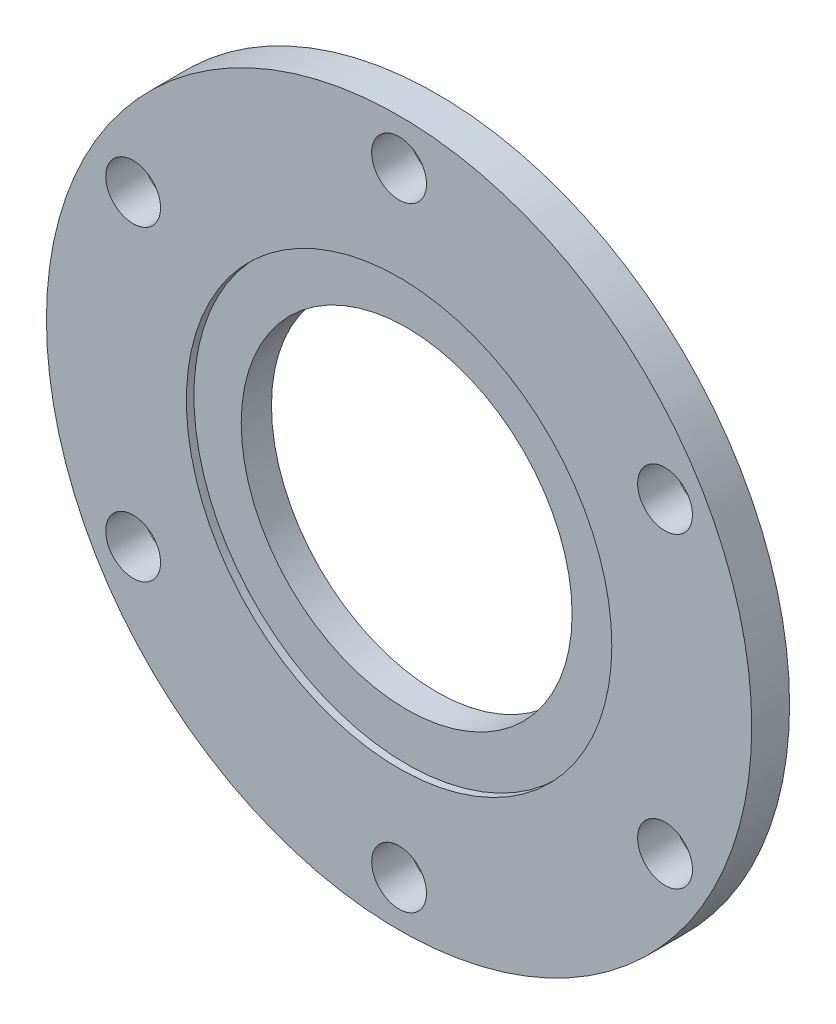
SolidWorks part; units mm, degrees
ref_plane "Front Plane" through (0, 0, 0) normal (0, 0, 1) x (1, 0, 0)
ref_plane "Top Plane" through (0, 0, 0) normal (0, 1, 0) x (1, 0, 0)
ref_plane "Right Plane" through (0, 0, 0) normal (1, 0, 0) x (0, 0, -1)
sketch "Sketch1" plane through (0, 0, 0) normal (0, 0, 1) x (1, 0, 0)
  circle A0 centre (0, 0) radius 11.1125
  circle A1 centre (0, 0) radius 23.6855
  dimension "D1" = 47.371
  dimension "D2" = 22.225
extrude "Boss-Extrude1" add sketch "Sketch1" along normal blind 2.54
sketch "Sketch2" plane through (0, 0, 2.54) normal (0, 0, 1) x (1, 0, 0)
  circle A0 centre (0, 0) radius 14.2875
  dimension "D1" = 28.575
extrude "Cut-Extrude1" cut sketch "Sketch2" against normal blind 0.508
sketch "Sketch3" plane through (0, 0, 2.54) normal (0, 0, 1) x (1, 0, 0)
  circle A0 centre (0, 20.6248) radius 1.8415
  dimension "D1" = 3.683
  dimension "D2" = 20.6248
extrude "Cut-Extrude2" cut sketch "Sketch3" against normal through all
pattern_circular "CirPattern1" count 6 over 360 about axis through (0, 0, 0) along (0, 0, 1) of "Cut-Extrude2"
